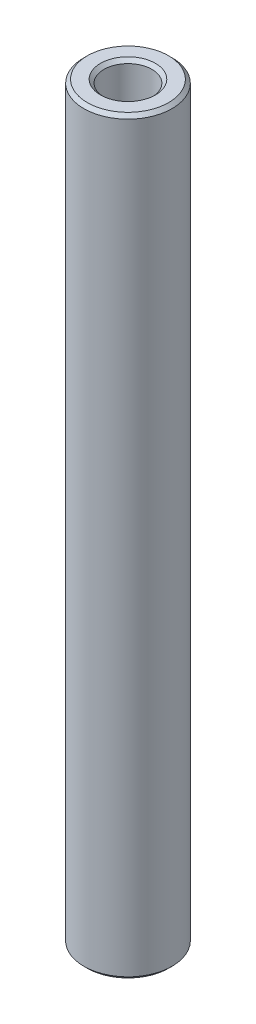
SolidWorks part; units mm, degrees
ref_plane "Front Plane" through (0, 0, 0) normal (0, 0, 1) x (1, 0, 0)
ref_plane "Top Plane" through (0, 0, 0) normal (0, 1, 0) x (1, 0, 0)
ref_plane "Right Plane" through (0, 0, 0) normal (1, 0, 0) x (0, 0, -1)
sketch "Sketch1" plane through (0, 0, 0) normal (0, 1, 0) x (1, 0, 0)
  circle A0 centre (0, 0) radius 3.175
  dimension "D1" = 6.35
extrude "Extrude1" add sketch "Sketch1" along normal blind 53.975
sketch "Sketch2" plane through (0, 53.975, 0) normal (0, 1, 0) x (1, 0, 0)
  circle A0 centre (0, 0) radius 1.7272
  dimension "D1" = 3.4544
extrude "Extrude2" cut sketch "Sketch2" against normal blind 31.75
chamfer "Chamfer1" distance 0.25 angle 45 3 edges at (0, 0, 3.175) (0, 53.975, 3.175) (0, 53.975, 1.7272)
